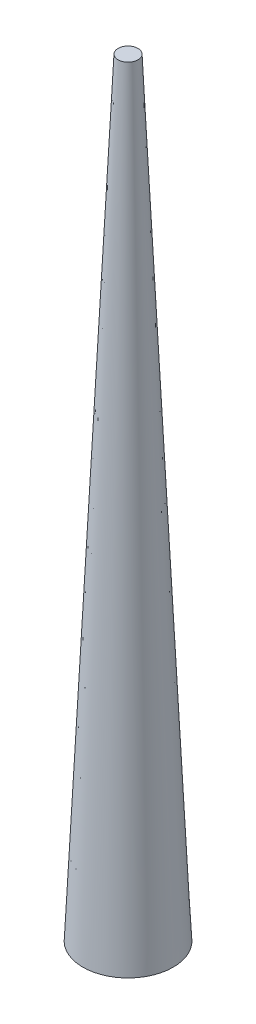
SolidWorks part; units mm, degrees
ref_plane "Front Plane" through (0, 0, 0) normal (0, 0, 1) x (1, 0, 0)
ref_plane "Top Plane" through (0, 0, 0) normal (0, 1, 0) x (1, 0, 0)
ref_plane "Right Plane" through (0, 0, 0) normal (1, 0, 0) x (0, 0, -1)
sketch "Sketch1" plane through (0, 0, 0) normal (0, 0, 1) x (1, 0, 0)
  line L0 (0, 90000) -> (0, 175000) construction
  line L1 (0, 90000) -> (5000, 90000)
  line L2 (5000, 90000) -> (1100, 175000)
  line L3 (1100, 175000) -> (0, 175000)
  line L4 (0, 175000) -> (0, 90000)
revolve "Revolve1" add sketch "Sketch1" angle 360 about L0
sketch "Sketch2" plane through (0, 0, 0) normal (0, 0, 1) x (1, 0, 0)
  circle A0 centre (5000, 120000) radius 4000
  circle A1 centre (5000, 140000) radius 3500
  circle A2 centre (5000, 160000) radius 2000
sketch "Sketch3" plane through (0, 0, 0) normal (0, 1, 0) x (1, 0, 0)
  line L1 (-18000, -600) -> (18000, -600)
  line L2 (-18000, -600) -> (-18000, 600)
  line L3 (-18000, 600) -> (18000, 600)
  line L4 (18000, -600) -> (18000, 600)
  line L5 (-600, -18000) -> (600, -18000)
  line L6 (-600, -18000) -> (-600, 18000)
  line L7 (-600, 18000) -> (600, 18000)
  line L8 (600, -18000) -> (600, 18000)
